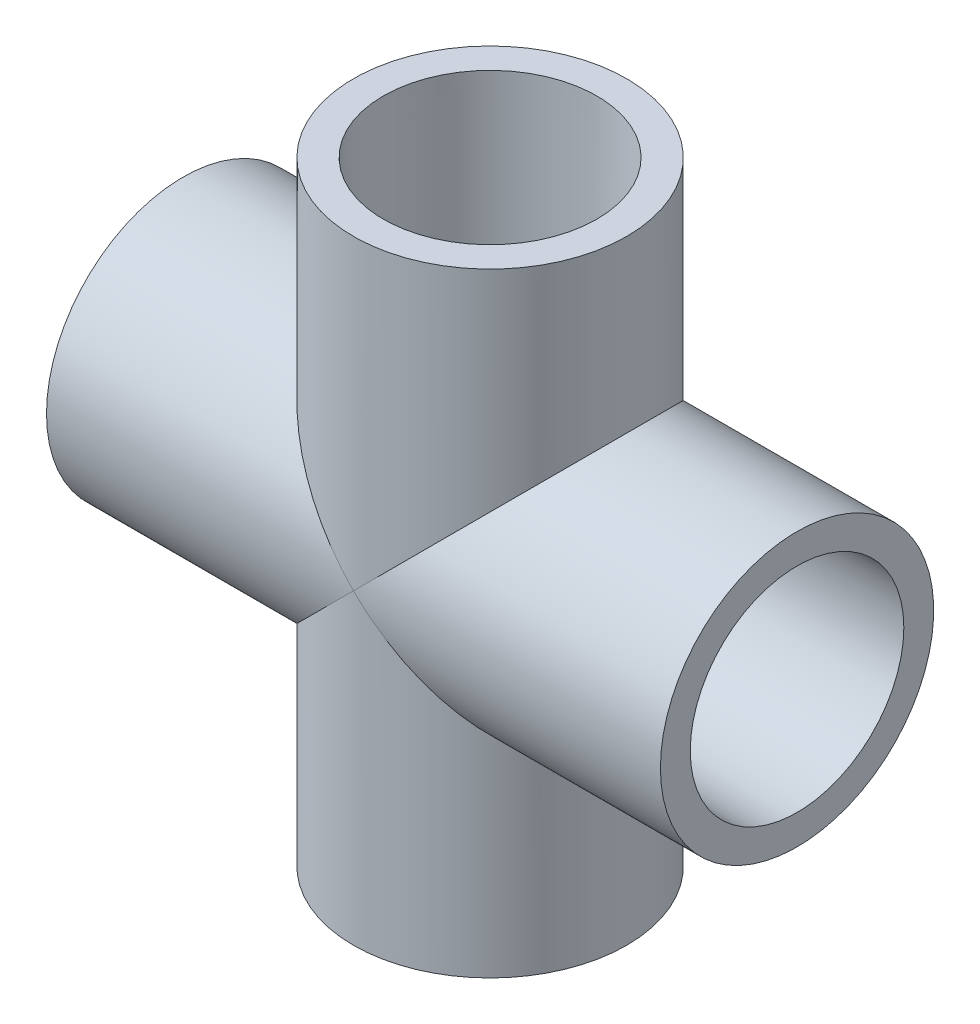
SolidWorks part; units mm, degrees
ref_plane "Front Plane" through (0, 0, 0) normal (0, 0, 1) x (1, 0, 0)
ref_plane "Top Plane" through (0, 0, 0) normal (0, 1, 0) x (1, 0, 0)
ref_plane "Right Plane" through (0, 0, 0) normal (1, 0, 0) x (0, 0, -1)
sketch "Sketch0" plane through (0, 0, 0) normal (0, 0, 1) x (1, 0, 0)
  line L0 (-30.9562, 0) -> (0, 0) construction
  line L1 (0, 0) -> (0, 30.9562) construction
  line L2 (-13.4937, 0) -> (0, 0) construction
  line L3 (0, 0) -> (0, 13.4937) construction
  line L4 (-30.9562, 13.7795) -> (-30.9562, -13.7795) construction
  line L5 (-13.4937, 10.6172) -> (-30.9562, 10.7696) construction
  line L6 (-13.4937, 10.6172) -> (-13.4937, -10.6172) construction
  line L7 (-13.4937, -10.6172) -> (-30.9562, -10.7696) construction
  line L8 (-30.9562, 10.7696) -> (-30.9562, -10.7696) construction
  line L9 (-13.7795, 30.9562) -> (13.7795, 30.9563) construction
  line L10 (-10.7696, 30.9562) -> (10.7696, 30.9563) construction
  line L11 (10.7696, 30.9563) -> (10.6172, 13.4937) construction
  line L12 (10.6172, 13.4937) -> (-10.6172, 13.4937) construction
  line L13 (-10.6172, 13.4937) -> (-10.7696, 30.9562) construction
  line L14 (-13.4937, 7.8994) -> (-13.4937, -7.8994) construction
  line L15 (-30.9562, 0) -> (-13.4937, 0) construction
  line L16 (0, 30.9562) -> (0, 13.4937) construction
  line L17 (0, 0) -> (13.4937, 0) construction
  line L18 (-7.8994, 13.4937) -> (7.8994, 13.4937) construction
  line L19 (13.4937, 0) -> (30.9562, 0) construction
  line L20 (0, 0) -> (0, -13.4937) construction
  line L21 (0, -13.4937) -> (0, -30.9562) construction
  dimension "H" = 30.9562
  dimension "G" = 13.4937
  dimension "M" = 27.559
  dimension "OD A" = 21.5392
  dimension "OD B" = 21.2344
  dimension "ID" = 15.7988
sketch "Sketch1" plane through (0, 0, 0) normal (0, 0, 1) x (1, 0, 0)
  line L0 (-30.9562, 0) -> (0, 0) construction
  line L1 (-30.9562, 0) -> (0, 0) construction
  line L2 (0, 0) -> (0, -13.7795) construction
  line L3 (-30.9562, -13.7795) -> (-13.4937, -13.7795)
  line L4 (-30.9562, -13.7795) -> (-30.9562, -10.7696)
  line L5 (-30.9562, -10.7696) -> (-13.4937, -10.6172)
  line L6 (-13.4937, -13.7795) -> (-13.4937, -10.6172)
  line L7 (-13.4937, -13.7795) -> (0, -13.7795) construction
  line L8 (30.9562, -10.7696) -> (13.4937, -10.6172)
  line L9 (30.9562, -13.7795) -> (30.9562, -10.7696)
  line L10 (13.4937, -13.7795) -> (13.4937, -10.6172)
  line L11 (30.9562, -13.7795) -> (13.4937, -13.7795)
revolve "Revolve1" add sketch "Sketch1" angle 360 about L1
sketch "Sketch2" plane through (0, 0, 0) normal (0, 0, 1) x (1, 0, 0)
  line L0 (10.7696, 30.9563) -> (10.6172, 13.4937)
  line L1 (10.6172, 13.4937) -> (13.7795, 13.4937)
  line L2 (13.7795, 13.4937) -> (13.7795, 30.9563)
  line L3 (13.7795, 30.9563) -> (10.7696, 30.9563)
  line L4 (0, 0) -> (0, 30.9562) construction
  line L5 (0, 0) -> (0, 30.9562) construction
  line L6 (0, 0) -> (13.4937, 0) construction
  line L7 (13.7795, -30.9563) -> (10.7696, -30.9563)
  line L8 (13.7795, -13.4937) -> (13.7795, -30.9563)
  line L9 (10.6172, -13.4937) -> (13.7795, -13.4937)
  line L10 (10.7696, -30.9563) -> (10.6172, -13.4937)
revolve "Revolve2" add sketch "Sketch2" angle 360 about L5
sketch "Sketch3" plane through (-13.4937, 0, 0) normal (1, 0, 0) x (0, 0, -1)
  circle A0 centre (0, 0) radius 7.8994
  circle A1 centre (0, 0) radius 13.7795
sketch "Sketch4" plane through (-13.4937, 0, 0) normal (1, 0, 0) x (0, 0, -1)
  circle A0 centre (0, 0) radius 13.7795 construction
  circle A1 centre (0, 0) radius 13.7795
extrude "Boss-Extrude1" add sketch "Sketch4" along normal up to vertex
sketch "Sketch5" plane through (0, 13.4938, 0) normal (0, -1, 0) x (1, 0, 0)
  circle A0 centre (0, 0) radius 13.7795 construction
  circle A1 centre (0, 0) radius 13.7795
extrude "Boss-Extrude2" add sketch "Sketch5" along normal up to vertex (26.9875 mm away)
sketch "Sketch6" plane through (0, 0, 0) normal (0, 0, 1) x (1, 0, 0)
  line L0 (-30.9562, -10.7696) -> (-13.4937, -10.6172)
  line L1 (-13.4937, -10.6172) -> (-13.4937, -7.8994)
  line L2 (-13.4937, -7.8994) -> (13.4937, -7.8994)
  line L3 (13.4937, -10.2436) -> (13.4937, 10.2436) construction
  line L4 (0, -7.8994) -> (0, 0) construction
  line L5 (13.4937, -10.6172) -> (13.4937, -7.8994)
  line L6 (30.9562, -10.7696) -> (30.9562, 10.7696) construction
  line L7 (30.9562, -13.7795) -> (30.9562, 13.7795) construction
  line L8 (30.9562, -10.7696) -> (30.9563, 0)
  line L9 (30.9563, 0) -> (-30.9562, 0)
  line L10 (-30.9562, 0) -> (-30.9562, -10.7696)
  line L11 (30.9562, -10.7696) -> (13.4937, -10.6172)
revolve "Cut-Revolve1" cut sketch "Sketch6" angle 360 about L9
sketch "Sketch7" plane through (0, 0, 0) normal (0, 0, 1) x (1, 0, 0)
  line L0 (10.7696, 30.9563) -> (10.6172, 13.4937)
  line L1 (10.6172, 13.4937) -> (7.8994, 13.4937)
  line L2 (7.8994, 13.4937) -> (7.8994, -13.4938)
  line L4 (7.8994, 0) -> (0, 0) construction
  line L5 (0, 30.9562) -> (0, -30.9562)
  line L6 (-13.7795, 30.9562) -> (13.7795, 30.9563) construction
  line L7 (0, 30.9562) -> (10.7696, 30.9563)
  line L8 (10.6172, -13.4938) -> (7.8994, -13.4938)
  line L9 (10.7696, -30.9563) -> (10.6172, -13.4938)
  line L10 (0, 0) -> (13.4937, 0) construction
  line L11 (0, -30.9562) -> (10.7696, -30.9563)
revolve "Cut-Revolve2" cut sketch "Sketch7" angle 360 about L5
